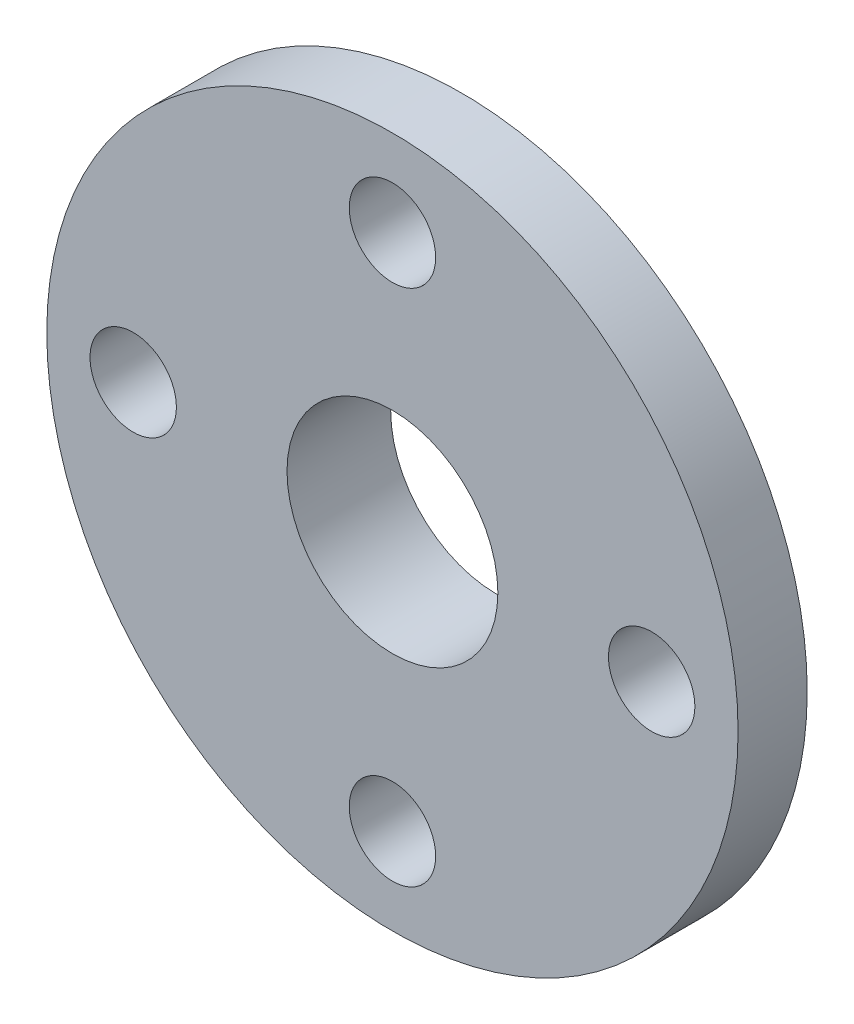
SolidWorks part; units mm, degrees
ref_plane "Plan de face" through (0, 0, 0) normal (0, 0, 1) x (1, 0, 0)
ref_plane "Plan de dessus" through (0, 0, 0) normal (0, 1, 0) x (1, 0, 0)
ref_plane "Plan de droite" through (0, 0, 0) normal (1, 0, 0) x (0, 0, -1)
sketch "Esquisse1" plane through (0, 0, 0) normal (0, 0, 1) x (1, 0, 0)
  line L0 (0, 0) -> (-7.5, 0) construction
  circle A0 centre (0, 0) radius 10
  circle A1 centre (-7.5, 0) radius 1.25
  circle A2 centre (0, 7.5) radius 1.25
  circle A3 centre (7.5, 0) radius 1.25
  circle A4 centre (0, -7.5) radius 1.25
  point P14 (0, 0)
  dimension "D1" = 20
  dimension "D2" = 2.5
  dimension "D3" = 7.5
  dimension "D4" = 4
extrude "Boss.-Extru.1" add sketch "Esquisse1" along normal blind 2
sketch "Esquisse2" plane through (0, 0, 0) normal (0, 0, -1) x (-1, 0, 0)
  circle A0 centre (0, 0) radius 4.5
  dimension "D1" = 9
extrude "Boss.-Extru.2" add sketch "Esquisse2" along normal blind 1
sketch "Esquisse3" plane through (0, 0, 2) normal (0, 0, 1) x (1, 0, 0)
  circle A0 centre (0, 0) radius 3.05
  dimension "D1" = 6.1
extrude "Enlèv. mat.-Extru.1" cut sketch "Esquisse3" against normal through all
